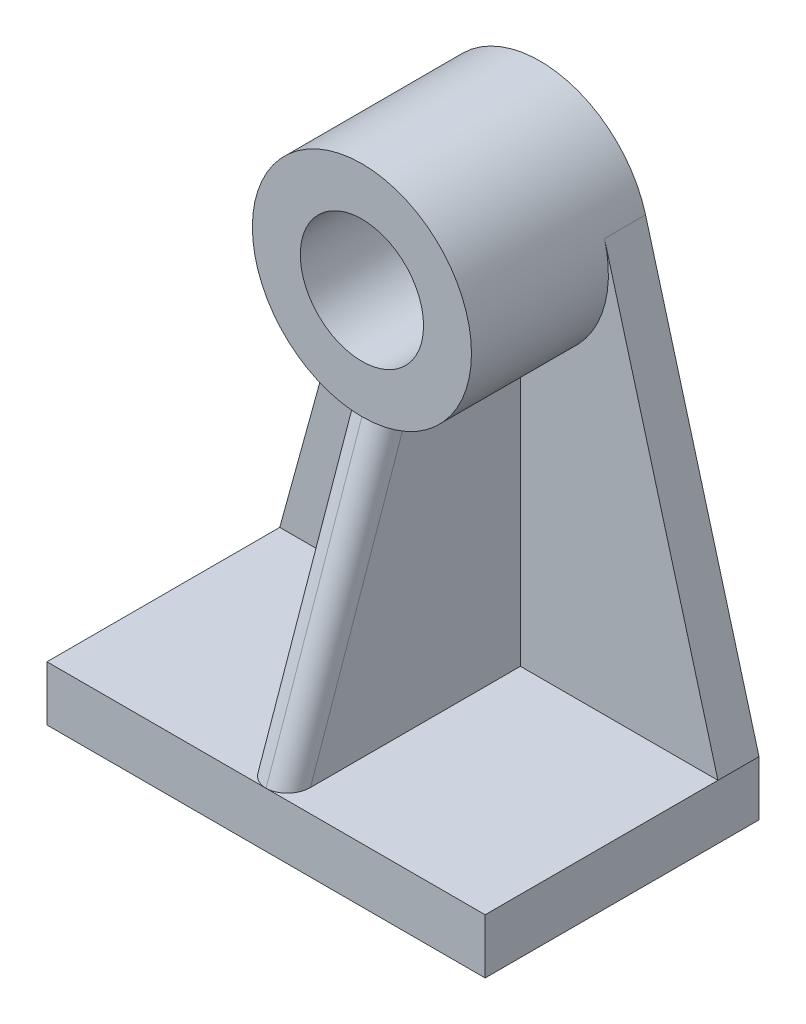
SolidWorks part; units mm, degrees
ref_plane "Plane1" through (0, 0, 0) normal (0, 0, 1) x (1, 0, 0)
ref_plane "Plane2" through (0, 0, 0) normal (0, 1, 0) x (1, 0, 0)
ref_plane "Rib Plane" through (0, 0, 0) normal (1, 0, 0) x (0, 0, -1)
sketch "Sketch1" plane through (0, 0, 0) normal (0, 0, 1) x (1, 0, 0)
  line L0 (-50.8, -101.6) -> (50.8, -101.6)
  line L1 (-50.8, -101.6) -> (-50.8, -88.9)
  line L2 (-50.8, -88.9) -> (-24.4902, 6.7373)
  line L3 (50.8, -101.6) -> (50.8, -88.9)
  line L4 (50.8, -88.9) -> (24.4902, 6.7373)
  arc A0 (24.4902, 6.7373) -> (-24.4902, 6.7373) centre (0, 0) ccw
  point P5 (0, -101.6)
  dimension "D1" = 50.8
  dimension "D2" = 101.6
  dimension "D3" = 101.6
  dimension "D4" = 12.7
extrude "Base-Extrude" add sketch "Sketch1" along normal blind 9.525
sketch "Sketch2" plane through (0, 0, 9.525) normal (0, 0, 1) x (1, 0, 0)
  line L0 (50.8, -101.6) -> (50.8, -88.9) construction
  line L1 (-50.8, -101.6) -> (50.8, -101.6) construction
  line L2 (-50.8, -88.9) -> (-50.8, -101.6) construction
  line L3 (50.8, -101.6) -> (50.8, -88.9)
  line L4 (-50.8, -101.6) -> (50.8, -101.6)
  line L5 (-50.8, -88.9) -> (-50.8, -101.6)
  line L6 (-50.8, -88.9) -> (50.8, -88.9)
extrude "Boss-Extrude1" add sketch "Sketch2" along normal blind 53.975
sketch "Sketch3" plane through (0, 0, 9.525) normal (0, 0, 1) x (1, 0, 0)
  circle A0 centre (0, 0) radius 25.4
  arc A1 (24.4902, 6.7373) -> (-24.4902, 6.7373) centre (0, 0) ccw construction
extrude "Boss-Extrude2" add sketch "Sketch3" along normal blind 31.75
sketch "Sketch4" plane through (0, 0, 41.275) normal (0, 0, 1) x (1, 0, 0)
  circle A0 centre (0, 0) radius 14.2875
  dimension "D1" = 28.575
extrude "Cut-Extrude1" cut sketch "Sketch4" against normal through all
sketch "Sketch5" plane through (0, 0, 0) normal (1, 0, 0) x (0, 0, -1)
  line L0 (-63.5, -88.9) -> (-41.275, -25.4)
  line L1 (-41.275, 25.4) -> (-41.275, -25.4) construction
rib "Rib1" sketch "Sketch5" sketch "Sketch5" thickness 10 extrusion direction parallel to sketch draft on no parameters "D1"=10
fillet "Fillet2" radius 5 2 edges at (-5, -56.9015, 52.3005) (5, -56.9015, 52.3005)
